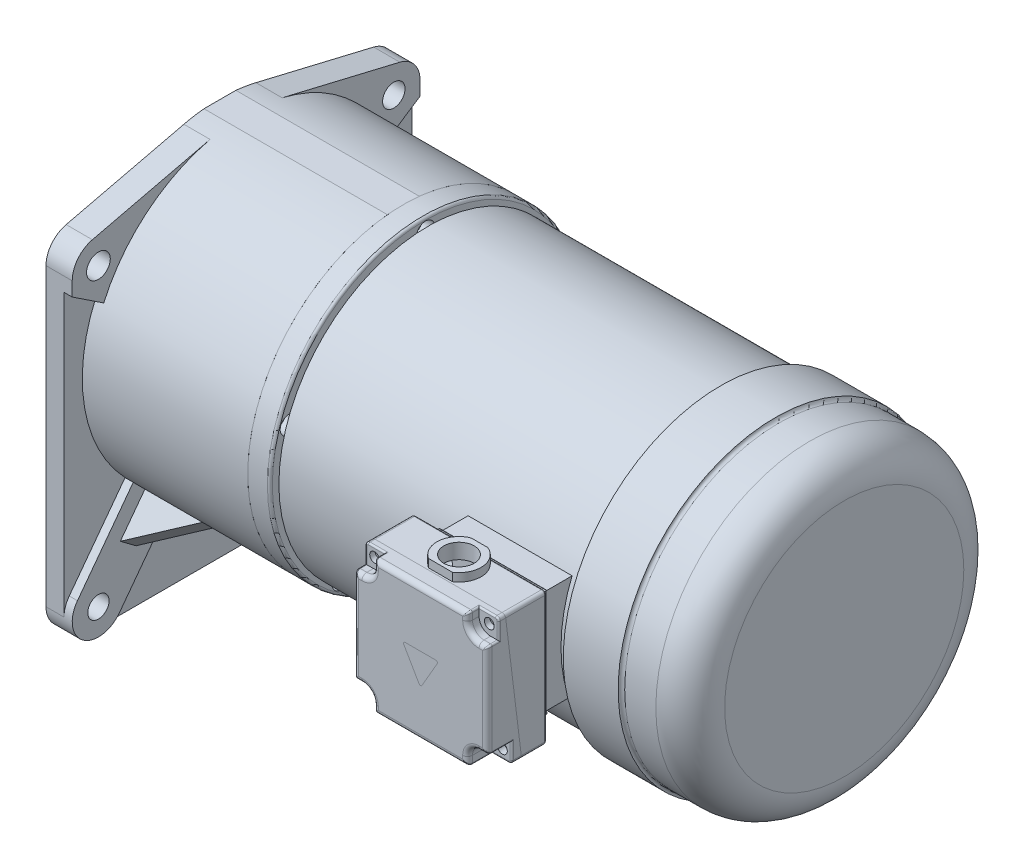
SolidWorks part; units mm, degrees
ref_plane "前视基准面" through (0, 0, 0) normal (0, 0, 1) x (1, 0, 0)
ref_plane "上视基准面" through (0, 0, 0) normal (0, 1, 0) x (1, 0, 0)
ref_plane "右视基准面" through (0, 0, 0) normal (1, 0, 0) x (0, 0, -1)
imported_body "接线盒座-1-surface1"
imported_body "接线盒座-1-surface2"
imported_body "接线盒座-1-surface3"
imported_body "接线盒座-1-surface4"
imported_body "接线盒座-1-surface5"
imported_body "接线盒座-1-surface6"
imported_body "接线盒盖-1-surface1"
imported_body "接线盒盖-1-surface2"
imported_body "接线盒盖-1-surface3"
imported_body "32立式装配体2-1/16.06.23 32立式箱体(现用A)-1-surface1"
imported_body "32立式装配体2-1/15.12.26 32箱盖(新)-1-surface1"
imported_body "32立式装配体2-1/32 出轴-1-surface1"
imported_body "32立式装配体2-1/32 出轴-1-surface2"
imported_body "32立式装配体2-1/35X55X10油封-1-surface1"
imported_body "32立式装配体2-1/透气塞-1-surface1"
imported_body "32立式装配体2-1/C10X50-1-surface1"
sketch "草图1" plane through (-87.0732, 0, 0) normal (1, 0, 0) x (0, 0, -1)
  circle A0 centre (42.3856, -70.4274) radius 91
extrude "凸台-拉伸1" add sketch "草图1" along normal blind 178.6
sketch "草图2" plane through (91.5268, 0, 0) normal (1, 0, 0) x (0, 0, -1)
  circle A0 centre (42.3856, -70.4274) radius 96
extrude "凸台-拉伸2" add sketch "草图2" along normal blind 33.5
sketch "草图3" plane through (125.0268, 0, 0) normal (1, 0, 0) x (0, 0, -1)
  circle A0 centre (42.3856, -70.4274) radius 94
extrude "凸台-拉伸3" add sketch "草图3" along normal blind 42
fillet "圆角1" radius 2 1 edges at (125.0268, -70.4274, -136.3856)
fillet "圆角2" radius 21 1 edges at (167.0268, -70.4274, -136.3856)
